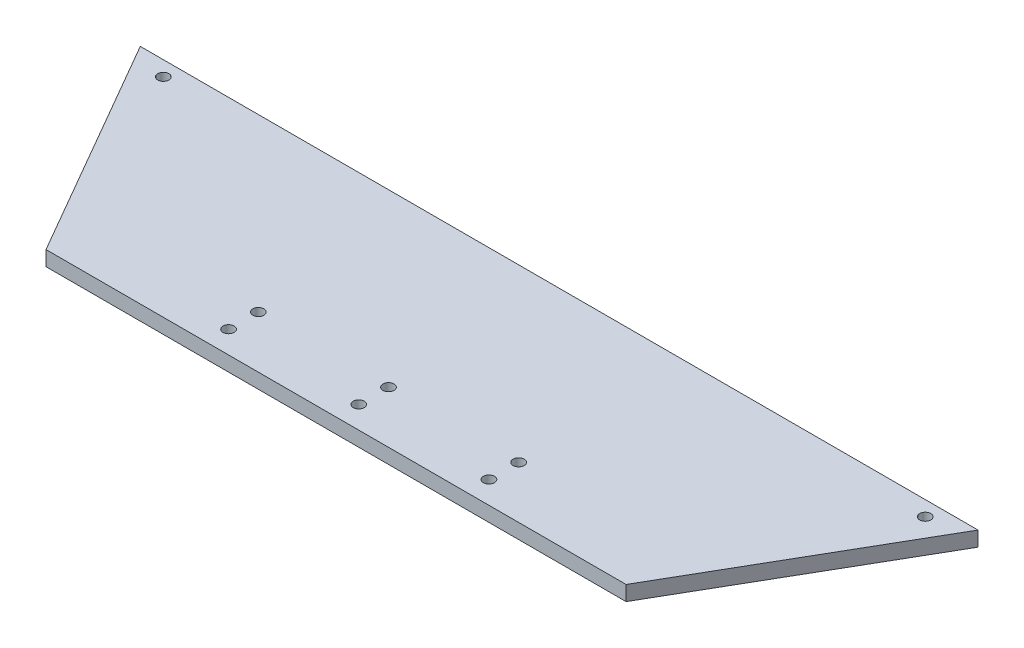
SolidWorks part; units mm, degrees
ref_plane "前视基准面" through (0, 0, 0) normal (0, 0, 1) x (1, 0, 0)
ref_plane "上视基准面" through (0, 0, 0) normal (0, 1, 0) x (1, 0, 0)
ref_plane "右视基准面" through (0, 0, 0) normal (1, 0, 0) x (0, 0, -1)
sketch "草图1" plane through (0, 0, 0) normal (0, 1, 0) x (1, 0, 0)
  line L0 (-78, 0) -> (78, 0)
  line L1 (0, 0) -> (0, 68.8049) construction
  line L2 (78, 0) -> (112.641, 60)
  line L3 (112.641, 60) -> (-112.641, 60)
  line L4 (-112.641, 60) -> (-78, 0)
  dimension "D1" = 156
  dimension "D2" = 60
  dimension "D3" = 60
  dimension "D4" = 60
extrude "凸台-拉伸1" add sketch "草图1" along normal blind 4
extrude "切除-拉伸5" cut sketch "草图6" against normal blind 20
sketch "草图6" plane through (24.2864, -3, 75) normal (0, -1, 0) x (-1, 0, 0)
  line L2 (24.2864, 135) -> (24.2864, 120.1246) construction
  circle A0 centre (-78.1696, 131) radius 1.5
  circle A1 centre (126.7423, 131) radius 1.5
sketch "草图7" plane through (0, -152.7978, 0) normal (0, -1, 0) x (-1, 0, 0)
  circle A0 centre (-35.1068, 14) radius 1.5
  circle A1 centre (-0.1068, 14) radius 1.5
  circle A2 centre (34.8932, 14) radius 1.5
  circle A3 centre (34.8932, 6) radius 1.5
  circle A4 centre (-0.1068, 6) radius 1.5
  circle A5 centre (-35.1068, 6) radius 1.5
  dimension "D1" = 3
  dimension "D2" = 3
  dimension "D3" = 3
  dimension "D4" = 2
extrude "切除-拉伸10" cut sketch "草图7" against normal through all
